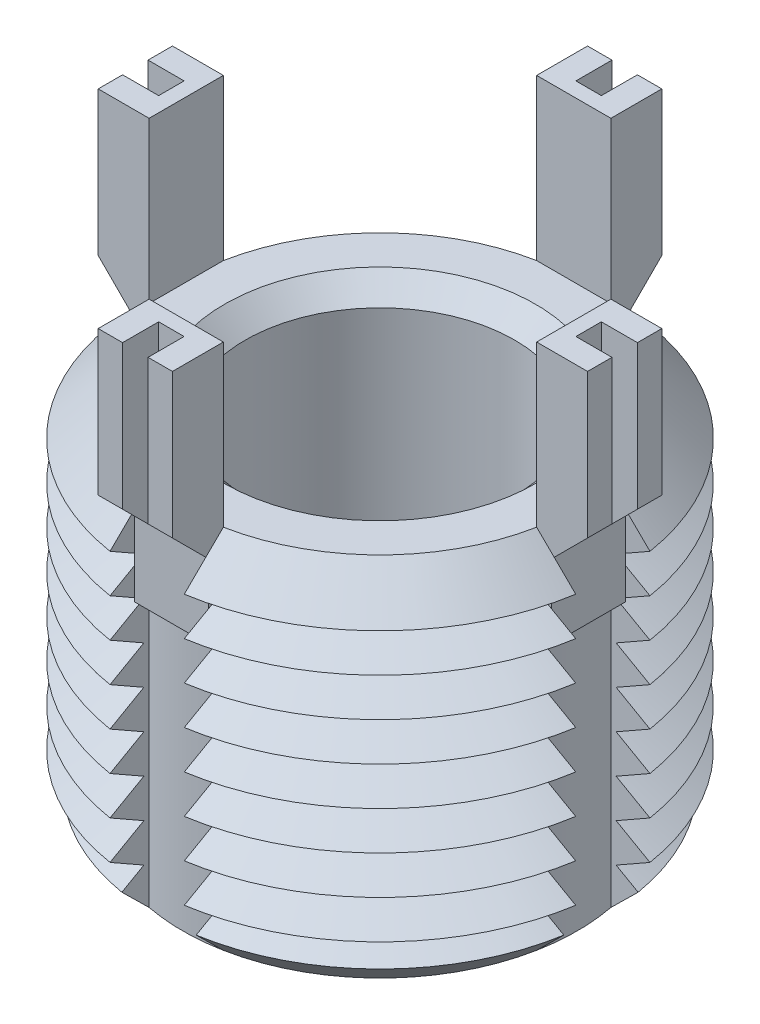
SolidWorks part; units mm, degrees
ref_plane "Front Plane" through (0, 0, 0) normal (0, 0, 1) x (1, 0, 0)
ref_plane "Top Plane" through (0, 0, 0) normal (0, 1, 0) x (1, 0, 0)
ref_plane "Right Plane" through (0, 0, 0) normal (1, 0, 0) x (0, 0, -1)
sketch "Sketch1" plane through (0, 0, 0) normal (0, 1, 0) x (1, 0, 0)
  circle A0 centre (0, 0) radius 11.1125
  dimension "D1" = 22.225
extrude "Boss-Extrude1" add sketch "Sketch1" against normal blind 17.272
chamfer "Chamfer1" distance 1.814 angle 45 2 edges at (0, -17.272, 11.1125) (0, 0, 11.1125)
sketch "Sketch2" plane through (0, 0, 0) normal (1, 0, 0) x (0, 0, -1)
  line L0 (0, 0.8859) -> (0, -9.2617) construction
sketch "Sketch3" plane through (0, 0, 0) normal (1, 0, 0) x (0, 0, -1)
  line L0 (-11.1125, -1.814) -> (-9.5415, -2.721)
  line L1 (-9.5415, -2.721) -> (-11.1125, -3.628)
  line L2 (-11.1125, -1.814) -> (-11.1125, -15.458) construction
  line L3 (-11.1125, -3.628) -> (-11.1125, -1.814)
  dimension "D1" = 1.814
revolve "Cut-Revolve1" cut sketch "Sketch3" angle 360 about L0
pattern_linear "LPattern1" count 8 spacing 1.814 along (0, -1, 0) of "Cut-Revolve1"
sketch "Sketch4" plane through (0, 0, 0) normal (0, 1, 0) x (1, 0, 0)
  line L0 (-9.1323, 1.75) -> (-10.9738, 1.75)
  line L2 (-10.9738, -1.75) -> (-9.1323, -1.75)
  arc A0 (-9.1323, 1.75) -> (-9.1323, -1.75) centre (0, 0) ccw
  arc A1 (-10.9738, 1.75) -> (-10.9738, -1.75) centre (0, 0) ccw
  circle A2 centre (0, 0) radius 11.1125 construction
  circle A3 centre (0, 0) radius 9.2985 construction
  point P1 (-9.2985, 0)
  point P3 (-11.1125, 0)
  point P13 (0, 0)
  dimension "D1" = 3.5
extrude "Cut-Extrude1" cut sketch "Sketch4" against normal up to surface (17.272 mm away)
pattern_circular "CirPattern1" count 4 over 360 about axis through (0, 0, 0) along (0, 1, 0) of "Cut-Extrude1"
sketch "Sketch5" plane through (0, 0, 0) normal (1, 0, 0) x (0, 0, -1)
  line L0 (-9.1323, 7.558) -> (-9.1323, -4.442)
  line L1 (-9.1323, -4.442) -> (-9.8323, -4.442)
  line L2 (-9.8323, -4.442) -> (-9.8323, -0.942)
  line L3 (-9.8323, -0.942) -> (-11.5323, 0.758)
  line L4 (-11.5323, 0.758) -> (-11.5323, 7.558)
  line L5 (-11.5323, 7.558) -> (-9.1323, 7.558)
  line L6 (-10.9738, -5.442) -> (-1.75, -5.442) construction
  point P9 (-1.75, 0)
  point P10 (-9.8323, -0.942)
  dimension "D1" = 1
  dimension "D2" = 12
  dimension "D3" = 8.5
  dimension "D4" = 2.4
  dimension "D5" = 0.7
  dimension "D6" = 45
extrude "Boss-Extrude3" add sketch "Sketch5" along normal mid plane 3.5
pattern_circular "CirPattern2" count 4 over 360 about axis through (0, 0, 0) along (0, 1, 0) of "Boss-Extrude3"
sketch "Sketch6" plane through (0, 7.558, 0) normal (0, 1, 0) x (1, 0, 0)
  line L0 (-11.5323, -1.75) -> (-11.5323, 1.75) construction
  line L1 (-11.5323, -0.6) -> (-9.8323, -0.6)
  line L2 (-11.5323, -0.6) -> (-11.5323, 0.6)
  line L3 (-11.5323, 0.6) -> (-9.8323, 0.6)
  line L4 (-9.8323, -0.6) -> (-9.8323, 0.6)
  line L5 (-11.5323, -0.6) -> (-9.8323, 0.6) construction
  line L6 (-11.5323, 0.6) -> (-9.8323, -0.6) construction
  line L7 (11.5323, 1.75) -> (11.5323, -1.75) construction
  line L8 (-0.6, 9.8323) -> (0.6, 9.8323)
  line L9 (-0.6, 9.8323) -> (-0.6, 11.5323)
  line L10 (-0.6, 11.5323) -> (0.6, 11.5323)
  line L11 (0.6, 9.8323) -> (0.6, 11.5323)
  line L12 (-0.6, 9.8323) -> (0.6, 11.5323) construction
  line L13 (-0.6, 11.5323) -> (0.6, 9.8323) construction
  line L14 (9.8323, -0.6) -> (11.5323, -0.6)
  line L15 (9.8323, -0.6) -> (9.8323, 0.6)
  line L16 (9.8323, 0.6) -> (11.5323, 0.6)
  line L17 (11.5323, -0.6) -> (11.5323, 0.6)
  line L18 (9.8323, -0.6) -> (11.5323, 0.6) construction
  line L19 (9.8323, 0.6) -> (11.5323, -0.6) construction
  line L20 (-0.6, -11.5323) -> (0.6, -11.5323)
  line L21 (-0.6, -11.5323) -> (-0.6, -9.8323)
  line L22 (-0.6, -9.8323) -> (0.6, -9.8323)
  line L23 (0.6, -11.5323) -> (0.6, -9.8323)
  line L24 (-0.6, -11.5323) -> (0.6, -9.8323) construction
  line L25 (-0.6, -9.8323) -> (0.6, -11.5323) construction
  line L26 (-1.75, 11.5323) -> (1.75, 11.5323) construction
  line L27 (1.75, -11.5323) -> (-1.75, -11.5323) construction
  point P0 (-10.6823, 0)
  point P7 (-11.5323, 0)
  point P8 (-11.5323, 0)
  point P9 (0, 10.6823)
  point P14 (10.6823, 0)
  point P19 (0, -10.6823)
  point P24 (0, 11.5323)
  point P25 (11.5323, 0)
  point P26 (11.5323, 0)
  point P27 (0, 11.5323)
  point P30 (0, -11.5323)
  point P33 (0, -11.5323)
  dimension "D1" = 1.2
  dimension "D2" = 1.7
extrude "Cut-Extrude3" cut sketch "Sketch6" against normal through all both and the other way through all
sketch "Sketch7" plane through (0, 0, 0) normal (0, 1, 0) x (1, 0, 0)
  circle A0 centre (0, 0) radius 6.35
  dimension "D1" = 12.7
extrude "Cut-Extrude4" cut sketch "Sketch7" against normal up to surface (17.272 mm away)
chamfer "Chamfer2" distance 0.977 angle 45 2 edges at (0, 0, 6.35) (0, -17.272, 6.35)
